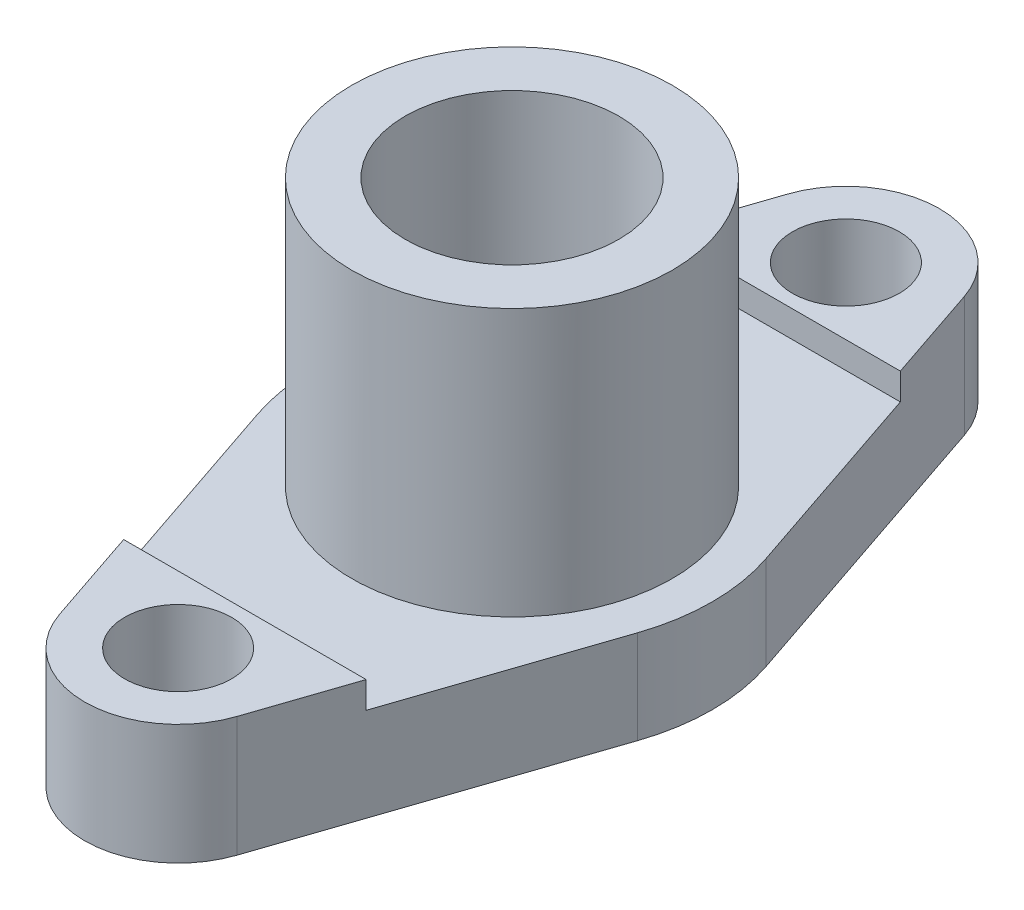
SolidWorks part; units mm, degrees
ref_plane "前视基准面" through (0, 0, 0) normal (0, 0, 1) x (1, 0, 0)
ref_plane "上视基准面" through (0, 0, 0) normal (0, 1, 0) x (1, 0, 0)
ref_plane "右视基准面" through (0, 0, 0) normal (1, 0, 0) x (0, 0, -1)
sketch "草图1" plane through (0, 0, 0) normal (0, 1, 0) x (1, 0, 0)
  circle A0 centre (0, 0) radius 12
  circle A1 centre (0, 0) radius 8
extrude "拉伸1" add sketch "草图1" along normal blind 27
sketch "草图2" plane through (0, 0, 0) normal (0, -1, 0) x (1, 0, 0)
  line L0 (0, 0) -> (0, -40.2281) construction
  line L1 (14.2113, -4.8) -> (6.6319, -27.24)
  line L2 (-14.2113, -4.8) -> (-6.6319, -27.24)
  line L3 (14.2113, 4.8) -> (6.6319, 27.24)
  line L4 (-6.6319, 27.24) -> (-14.2113, 4.8)
  arc A0 (14.2113, -4.8) -> (14.2113, 4.8) centre (0, 0) ccw
  arc A1 (-6.6319, -27.24) -> (6.6319, -27.24) centre (0, -25) ccw
  arc A2 (6.6319, 27.24) -> (-6.6319, 27.24) centre (0, 25) ccw
  arc A3 (-14.2113, 4.8) -> (-14.2113, -4.8) centre (0, 0) ccw
  circle A4 centre (0, -25) radius 4
  circle A5 centre (0, 25) radius 4
  circle A6 centre (0, 0) radius 8
  dimension "D1" = 14
  dimension "D2" = 14
extrude "拉伸2" add sketch "草图2" against normal blind 7
sketch "草图3" plane through (0, 7, 0) normal (0, 1, 0) x (-1, 0, 0)
  line L0 (-9.0773, -20) -> (9.0773, -20)
  line L1 (-6.6319, -27.24) -> (-14.2113, -4.8) construction
  line L2 (14.2113, -4.8) -> (6.6319, -27.24) construction
  line L3 (9.0773, -20) -> (6.6319, -27.24)
  line L6 (-9.0773, -20) -> (-6.6319, -27.24)
  line L7 (-9.0773, 20) -> (-6.6319, 27.24)
  line L8 (0, 0) -> (24.3231, 0) construction
  line L9 (9.0773, 20) -> (6.6319, 27.24)
  line L10 (-9.0773, 20) -> (9.0773, 20)
  circle A0 centre (0, -25) radius 4 construction
  circle A2 centre (0, -25) radius 4
  arc A3 (-6.6319, -27.24) -> (6.6319, -27.24) centre (0, -25) ccw
  arc A4 (-6.6319, 27.24) -> (6.6319, 27.24) centre (0, 25) cw
  circle A5 centre (0, 25) radius 4
  dimension "D1" = 5
extrude "拉伸3" add sketch "草图3" along normal blind 2
